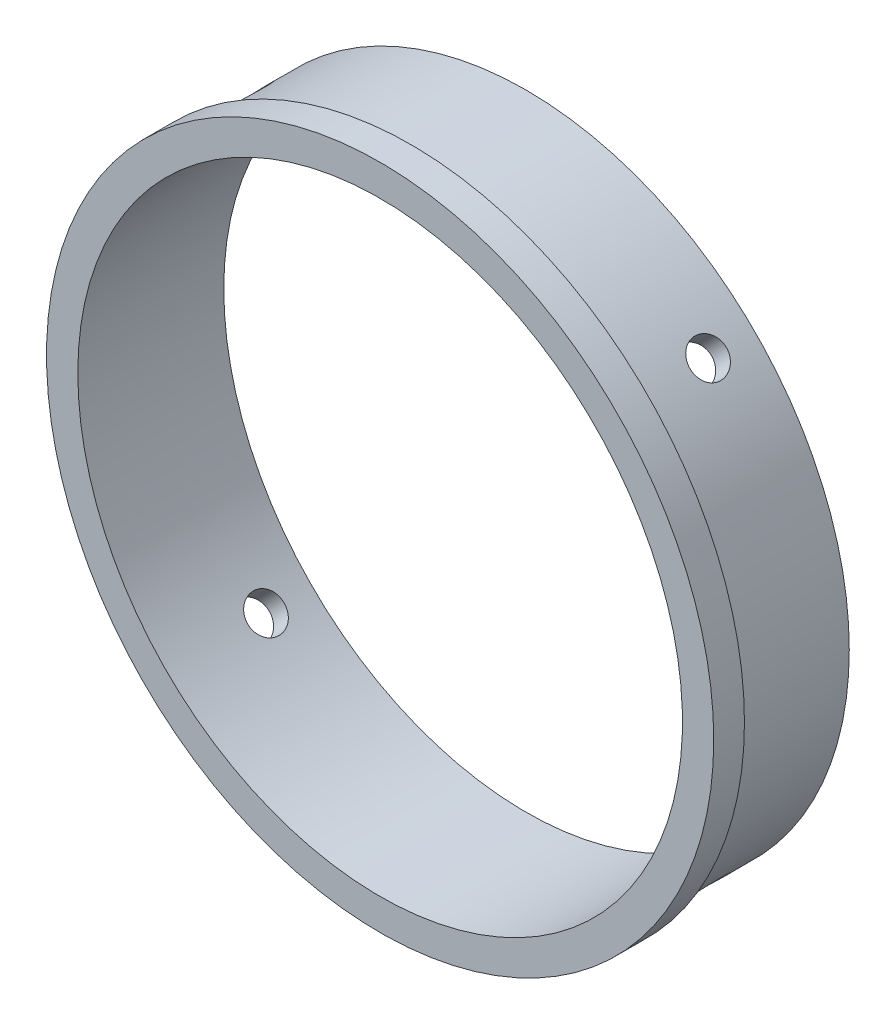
SolidWorks part; units mm, degrees
ref_plane "Front" through (0, 0, 0) normal (0, 0, 1) x (1, 0, 0)
ref_plane "Top" through (0, 0, 0) normal (0, 1, 0) x (1, 0, 0)
ref_plane "Right" through (0, 0, 0) normal (1, 0, 0) x (0, 0, -1)
sketch "Sketch1" plane through (0, 0, 0) normal (0, 0, 1) x (1, 0, 0)
  circle A0 centre (0, 0) radius 1.5
  circle A1 centre (0, 0) radius 47.625
  dimension "D1" = 3
  dimension "D2" = 95.25
extrude "Boss-Extrude1" add sketch "Sketch1" along normal mid plane 65
sketch "Sketch4" plane through (0, 0, 0) normal (1, 0, 0) x (0, 0, -1)
  line L0 (32.5, 47.625) -> (-32.5, 47.625) construction
  line L1 (-32.5, 47.625) -> (-32.5, -47.625) construction
  line L3 (-53.3071, 0) -> (-32.5, 0)
  line L5 (15.125, 47.625) -> (15.125, 65.1031)
  line L6 (15.125, 65.1031) -> (-53.3071, 65.1031)
  line L7 (-53.3071, 65.1031) -> (-53.3071, 0)
  arc A0 (15.125, 47.625) -> (-32.5, 0) centre (15.125, 0) ccw
  dimension "D1" = 47.625
revolve "Cut-Revolve1" cut sketch "Sketch4" angle 360 about L3
sketch "Sketch6" plane through (0, 0, 0) normal (1, 0, 0) x (0, 0, -1)
  line L0 (0, 0) -> (1422.5, 0) construction
  line L1 (-77.5, 20) -> (-77.5, -20) construction
  line L2 (0, 0) -> (-77.5, 0) construction
  line L3 (12.5, 4) -> (12.5, 2.5)
  line L4 (1422.5, 20) -> (1422.5, -20) construction
  line L5 (32.5, -47.625) -> (32.5, 47.625) construction
  line L6 (12.5, 4) -> (32.5, 4)
  line L7 (32.5, 4) -> (32.5, 0)
  line L8 (12.5, 2.5) -> (-32.4764, 2.5)
  line L9 (-32.4764, 0) -> (32.5, 0)
  line L10 (-32.4764, 2.5) -> (-32.4764, 0)
  line L11 (1422.5, -20) -> (-77.5, 2.8723) construction
  line L14 (-32.4764, -1.5) -> (-32.4764, 1.5) construction
  point P15 (-32.4764, 2.1858)
  point P19 (12.5, 1.5)
  dimension "D1" = 40
  dimension "D2" = 20
  dimension "D3" = 8
  dimension "D4" = 5
  dimension "D5" = 90
  dimension "D6" = 1500
  dimension "D7" = 3
  dimension "D8" = 4.3716
revolve "Cut-Revolve2" cut sketch "Sketch6" angle 360 about L9
sketch "Sketch10" plane through (0, 0, 0) normal (1, 0, 0) x (0, 0, -1)
  line L0 (37.35, 47.625) -> (37.35, 49.2125)
  line L1 (37.35, 49.2125) -> (19.8011, 49.2125)
  line L2 (19.8011, 49.2125) -> (19.8011, 50.8)
  line L3 (19.8011, 50.8) -> (15.125, 50.8)
  line L4 (15.125, 50.8) -> (15.125, 47.625)
  line L5 (15.125, 47.625) -> (37.35, 47.625)
  line L6 (0, 0) -> (41.9062, 0) construction
  dimension "D1" = 98.425
  dimension "D2" = 101.6
  dimension "D3" = 17.5489
  dimension "D4" = 22.225
revolve "Revolve1" add sketch "Sketch10" angle 360 about L6
fillet "Fillet3" radius 3.175 1 edges at (0, 2.5, 32.4343)
ref_plane "TARGET" through (0, 0, 75) normal (0, 0, 1) x (1, 0, 0)
ref_plane "Plane2" through (0, 47.625, 0) normal (0, 1, 0) x (-1, 0, 0)
hole_wizard "1/4-20 Tapped Hole1" positions "Sketch9" profile "Sketch8" tap size "1/4-20" standard "Ansi Inch"
sketch "Sketch9" plane through (0, 47.625, 0) normal (0, 1, 0) x (-1, 0, 0)
  line L1 (-49.2125, -37.35) -> (49.2125, -37.35) construction
  point P1 (0, -8.775)
  dimension "D1" = 28.575
sketch "Sketch8" plane through (0, 47.625, -8.775) normal (1, 0, 0) x (0, 0, 1)
  line L0 (0, 0) -> (0, 48.3651)
  line L1 (0, 48.3651) -> (2.5527, 46.8312)
  line L2 (2.5527, 46.8312) -> (2.5527, 0)
  line L5 (2.5527, 0) -> (0, 0)
  line L10 (0, 48.3651) -> (-2.5527, 46.8312) construction
  line L11 (0, -6.35) -> (0, 107.95) construction
  dimension "Tap Drill Dia." = 5.1054
  dimension "Tap Drill Depth" = 46.8312
  dimension "Drill Angle" = 118
sketch "Sketch12" plane through (0, 0, -32.5) normal (0, 0, -1) x (-1, 0, 0)
  circle A0 centre (0, 0) radius 47.625 construction
  circle A1 centre (0, 0) radius 47.625
  circle A2 centre (0, 0) radius 4 construction
  circle A3 centre (0, 0) radius 4
extrude "Boss-Extrude3" add sketch "Sketch12" along normal up to surface (4.85 mm away)
sketch "Sketch20" plane through (0, 0, -37.35) normal (0, 0, -1) x (-1, 0, 0)
  circle A0 centre (0, 0) radius 46.0375
  circle A1 centre (0, 0) radius 49.2125 construction
  dimension "D1" = 3.175
extrude "Cut-Extrude4" cut sketch "Sketch20" against normal up to surface (22.225 mm away)
sketch "Sketch21" plane through (0, 0, 0) normal (1, 0, 0) x (0, 0, -1)
  line L0 (15.125, 54.5735) -> (15.125, -54.4561)
  line L1 (15.125, 47.625) -> (15.125, -47.625) construction
extrude "Cut-Extrude5" cut sketch "Sketch21" against normal through all and the other way through all flip side to cut
ref_plane "Plane3" through (34.7985, 34.7985, 0) normal (0.7071, 0.7071, 0) x (0, 0, -1)
hole_wizard "7/32 (0.21875) Diameter Hole1" positions "Sketch14" profile "Sketch13" hole size "7/32" standard "Ansi Inch"
sketch "Sketch14" plane through (34.7985, 34.7985, 0) normal (0.7071, 0.7071, 0) x (0, 0, -1)
  line L3 (15.125, 50.8) -> (15.125, -50.8) construction
  point P1 (30.2786, 0)
  dimension "D1" = 15.1536
sketch "Sketch13" plane through (34.7985, 34.7985, -30.2786) normal (0, 0, 1) x (-0.7071, 0.7071, 0)
  line L0 (0, 0) -> (0, 14.3693)
  line L1 (0, 14.3693) -> (2.7781, 12.7)
  line L2 (2.7781, 12.7) -> (2.7781, 0)
  line L5 (2.7781, 0) -> (0, 0)
  line L10 (0, 14.3693) -> (-2.7781, 12.7) construction
  line L11 (0, -6.35) -> (0, 107.95) construction
  dimension "Hole Dia." = 5.5562
  dimension "Hole Depth" = 12.7
  dimension "Drill Angle" = 118
pattern_circular "CirPattern1" count 4 over 360 of "7/32 (0.21875) Diameter Hole1"
sketch "Sketch15" [suppressed] plane through (0, 0, 0) normal (1, 0, 0) x (0, 0, -1)
  line L0 (-32.1103, 44.9352) -> (-32.1103, -44.7953)
ref_plane "Plane4" [suppressed] through (-32.5534, -32.5534, 0) normal (-0.7071, -0.7071, 0) x (0, 0, -1)
ref_plane "Plane5" [suppressed] through (32.5534, -32.5534, 0) normal (0.7071, -0.7071, 0) x (0, 0, -1)
sketch "Sketch19" [suppressed] plane through (32.5534, -32.5534, 0) normal (0.7071, -0.7071, 0) x (0, 0, -1)
  line L0 (5.5136, 53.1812) -> (5.5136, 45.2437) construction
  line L1 (13.4511, 53.1812) -> (-2.4239, 53.1812)
  line L2 (13.4511, 53.1812) -> (13.4511, 45.2437)
  line L3 (13.4511, 45.2437) -> (-2.4239, 45.2437)
  line L4 (-2.4239, 53.1812) -> (-2.4239, 45.2437)
  line L7 (37.35, -46.0375) -> (37.35, 46.0375) construction
  dimension "D1" = 23.8989
  dimension "D2" = 15.875
  dimension "D3" = 2.3813
  dimension "D4" = 7.9375
extrude "Cut-Extrude3" [suppressed] cut sketch "Sketch19" against normal through all
hole_wizard "#10-32 Tapped Hole3" positions "Sketch17" profile "Sketch16" tap size "#10-32" standard "Ansi Inch"
sketch "Sketch17" [suppressed] plane through (34.1389, 29.8454, 1.1042) normal (0.7071, 0.7071, 0) x (0, 0, -1)
  line L2 (38.4542, -43.0015) -> (38.4542, 49.0735) construction
  point P0 (8.2053, 3.036)
  dimension "D1" = 30.2489
sketch "Sketch16" plane through (31.9922, 31.9922, -7.1011) normal (0, 0, 1) x (-0.7071, 0.7071, 0)
  line L0 (0, 0) -> (0, 45.6633)
  line L1 (0, 45.6633) -> (2.0193, 44.45)
  line L2 (2.0193, 44.45) -> (2.0193, 0)
  line L5 (2.0193, 0) -> (0, 0)
  line L10 (0, 45.6633) -> (-2.0193, 44.45) construction
  line L11 (0, -6.35) -> (0, 107.95) construction
  dimension "Tap Drill Dia." = 4.0386
  dimension "Tap Drill Depth" = 44.45
  dimension "Drill Angle" = 118
pattern_circular "CirPattern2" [suppressed] count 2 over 270
